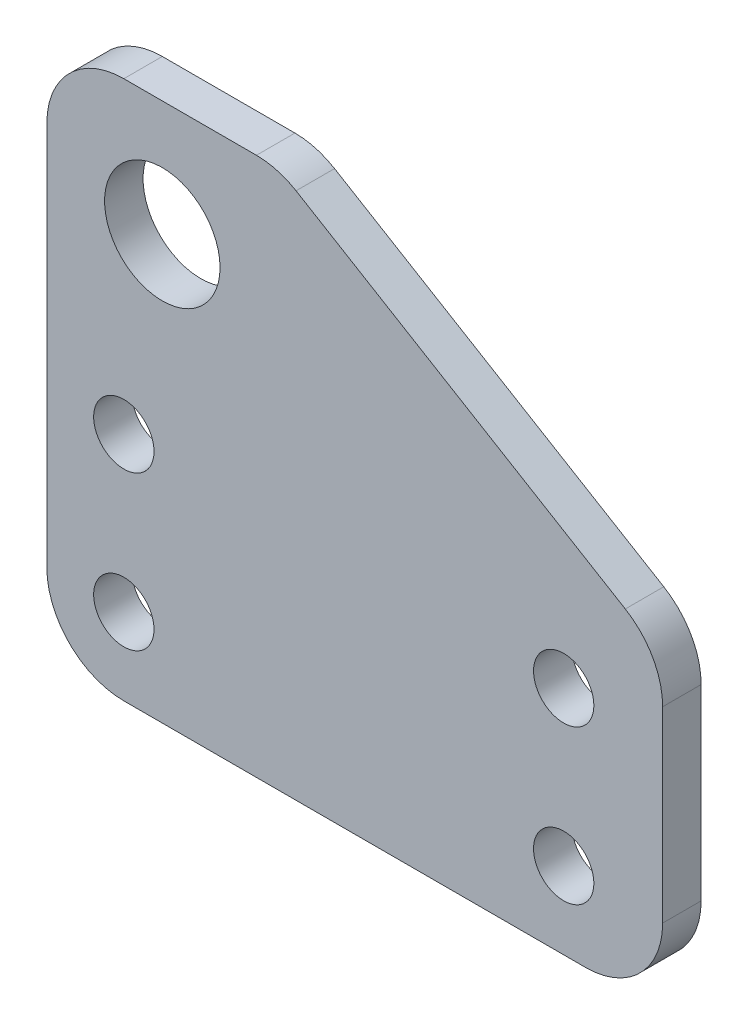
SolidWorks part; units mm, degrees
ref_plane "Front" through (0, 0, 0) normal (0, 0, 1) x (1, 0, 0)
ref_plane "Top" through (0, 0, 0) normal (0, 1, 0) x (1, 0, 0)
ref_plane "Right" through (0, 0, 0) normal (1, 0, 0) x (0, 0, -1)
sketch "Sketch1" plane through (0, 0, 0) normal (0, 0, 1) x (1, 0, 0)
  line L0 (50.8, 0) -> (0, 0)
  line L1 (0, 0) -> (0, 44.45)
  line L2 (0, 44.45) -> (19.05, 44.45)
  line L3 (50.8, 0) -> (50.8, 25.4)
  line L4 (50.8, 25.4) -> (19.05, 44.45)
  line L5 (25.4, 0) -> (19.05, 44.45) construction
  line L6 (42.6357, 6.35) -> (6.35, 6.35) construction
  line L7 (42.6357, 6.35) -> (42.6357, 19.05) construction
  line L8 (42.6357, 19.05) -> (6.35, 19.05) construction
  line L9 (6.35, 6.35) -> (6.35, 19.05) construction
  line L10 (50.8, 12.7) -> (0, 12.7) construction
  line L11 (9.525, 44.45) -> (9.525, 34.925) construction
  line L12 (9.525, 34.925) -> (0, 34.925) construction
  circle A0 centre (6.35, 19.05) radius 2.4892
  circle A1 centre (42.6357, 19.05) radius 2.4892
  circle A2 centre (42.6357, 6.35) radius 2.4892
  circle A3 centre (6.35, 6.35) radius 2.4892
  circle A4 centre (9.525, 34.925) radius 4.7625
  point P11 (24.4929, 6.35)
  point P14 (42.6357, 12.7)
  dimension "D7" = 4.9784
  dimension "D8" = 9.525
  dimension "D1" = 25.4
  dimension "D2" = 50.8
  dimension "D3" = 44.45
  dimension "D4" = 19.05
  dimension "D5" = 6.35
  dimension "D6" = 6.35
extrude "Boss-Extrude1" add sketch "Sketch1" along normal blind 3.175
fillet "Fillet1" radius 6.35 5 edges at (0, 44.45, 1.5875) (0, 0, 1.5875) (50.8, 0, 1.5875) (50.8, 25.4, 1.5875) (19.05, 44.45, 1.5875)
